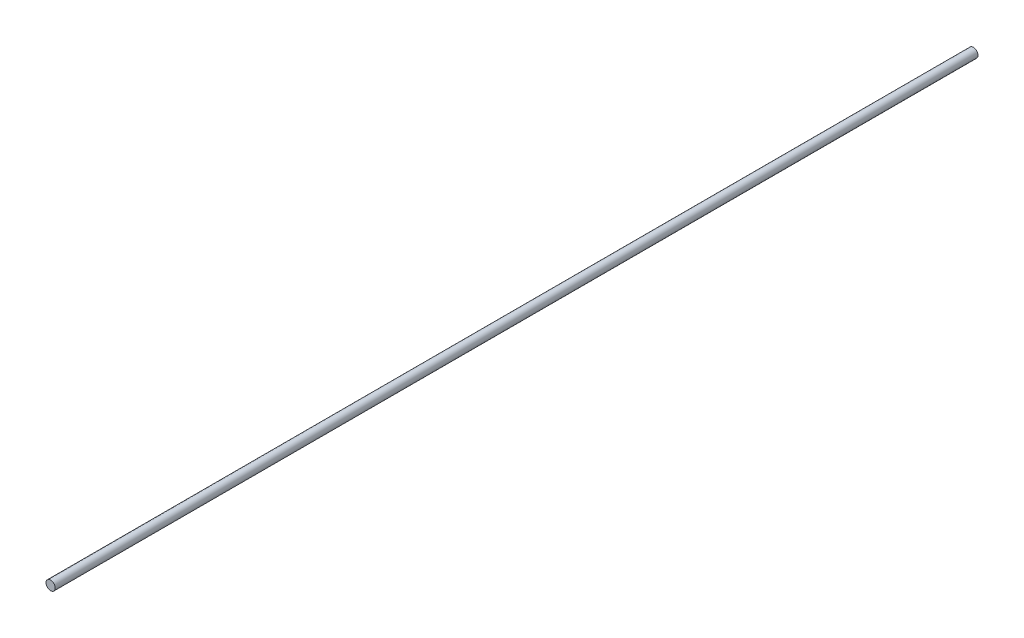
SolidWorks part; units mm, degrees
ref_plane "Front Plane" through (0, 0, 0) normal (0, 0, 1) x (1, 0, 0)
ref_plane "Top Plane" through (0, 0, 0) normal (0, 1, 0) x (1, 0, 0)
ref_plane "Right Plane" through (0, 0, 0) normal (1, 0, 0) x (0, 0, -1)
sketch "Sketch1" plane through (0, 0, 0) normal (0, 0, 1) x (1, 0, 0)
  circle A0 centre (0, 0) radius 30
  dimension "D1" = 60
extrude "Boss-Extrude1" add sketch "Sketch1" against normal blind 6000
